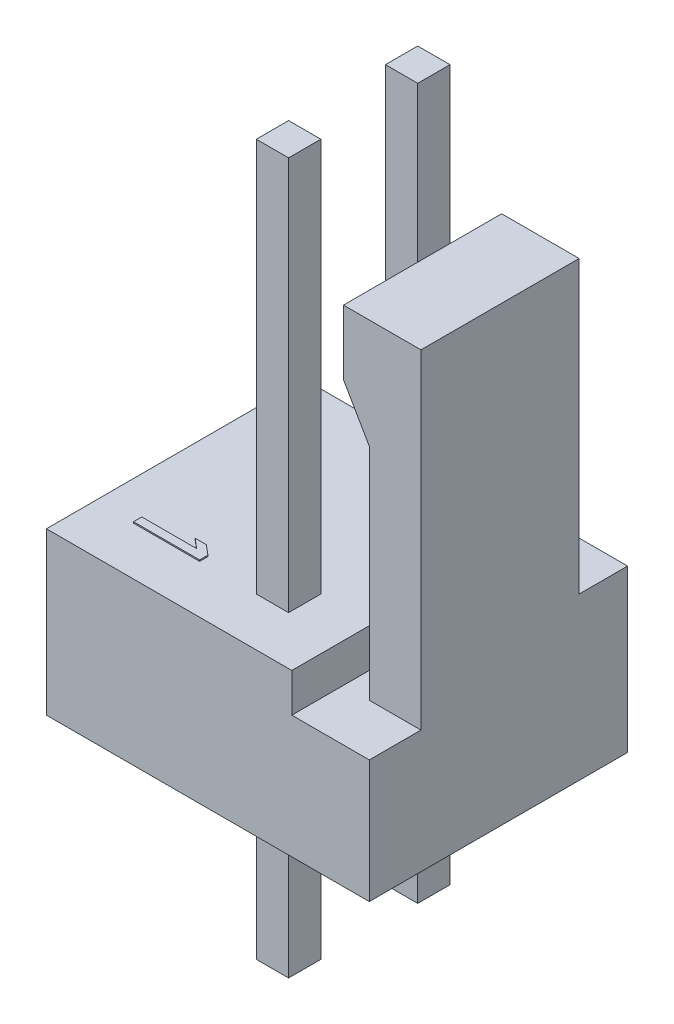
SolidWorks part; units mm, degrees
ref_plane "Front Plane" through (0, 0, 0) normal (0, 0, 1) x (1, 0, 0)
ref_plane "Top Plane" through (0, 0, 0) normal (0, 1, 0) x (1, 0, 0)
ref_plane "Right Plane" through (0, 0, 0) normal (1, 0, 0) x (0, 0, -1)
imported_body "Imported1"
sketch "Sketch1" plane through (0, 0, 0) normal (0, 1, 0) x (1, 0, 0)
  line L0 (-3.3385, 12.7) -> (9.165, 12.7) construction
  line L1 (3.81, 11.7475) -> (3.175, 11.7475) construction
  line L2 (3.175, 13.6525) -> (3.81, 13.6525) construction
  line L4 (-1.5687, 12.7) -> (6.9443, 12.7)
  line L5 (-1.5687, 12.7) -> (-1.5687, 19.0345)
  line L6 (-1.5687, 19.0345) -> (6.9443, 19.0345)
  line L7 (6.9443, 12.7) -> (6.9443, 19.0345)
extrude "Cut-Extrude1" cut sketch "Sketch1" against normal through all and the other way through all
sketch "Sketch2" plane through (0, 4.699, 0) normal (0, 1, 0) x (1, 0, 0)
  line L0 (3.81, 11.7475) -> (3.175, 11.7475) construction
  line L1 (-1.9834, 11.7475) -> (11.706, 11.7475)
  line L2 (-1.9834, 11.7475) -> (-1.9834, 14.9566)
  line L3 (-1.9834, 14.9566) -> (11.706, 14.9566)
  line L4 (11.706, 11.7475) -> (11.706, 14.9566)
extrude "Cut-Extrude2" cut sketch "Sketch2" along normal through all
